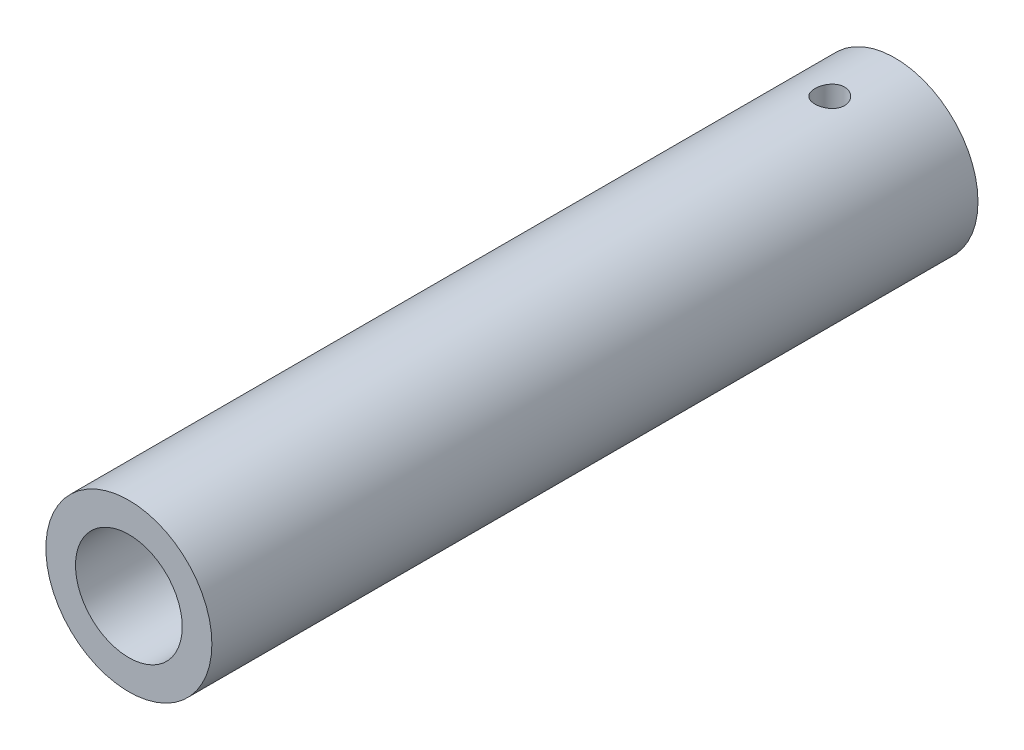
SolidWorks part; units mm, degrees
ref_plane "Plan de face" through (0, 0, 0) normal (0, 0, 1) x (1, 0, 0)
ref_plane "Plan de dessus" through (0, 0, 0) normal (0, 1, 0) x (1, 0, 0)
ref_plane "Plan de droite" through (0, 0, 0) normal (1, 0, 0) x (0, 0, -1)
sketch "Esquisse1" plane through (0, 0, 0) normal (0, 0, 1) x (1, 0, 0)
  circle A0 centre (0, 0) radius 14
  circle A1 centre (0, 0) radius 9
  dimension "D1" = 18
  dimension "D2" = 28
extrude "Extrusion1" add sketch "Esquisse1" along normal blind 129.2
sketch "Esquisse2" plane through (0, 0, 0) normal (0, 1, 0) x (1, 0, 0)
  circle A0 centre (0, -11) radius 2.5
  dimension "D1" = 5
  dimension "D2" = 11
extrude "Enlèv. mat.-Extru.1" cut sketch "Esquisse2" against normal mid plane 30
